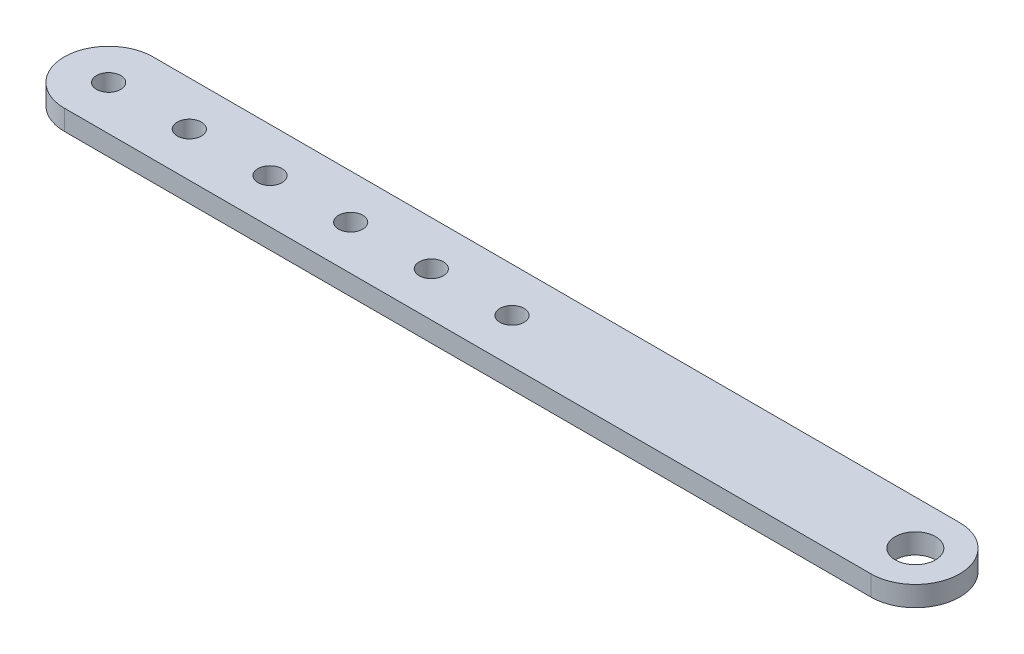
SolidWorks part; units mm, degrees
ref_plane "Front" through (0, 0, 0) normal (0, 0, 1) x (1, 0, 0)
ref_plane "Top" through (0, 0, 0) normal (0, 1, 0) x (1, 0, 0)
ref_plane "Right" through (0, 0, 0) normal (1, 0, 0) x (0, 0, -1)
sketch "Sketch2" plane through (0, 0, 0) normal (0, 1, 0) x (1, 0, 0)
  line L0 (0, 0) -> (200, 0) construction
  line L1 (0, 11) -> (200, 11)
  line L2 (0, -11) -> (200, -11)
  arc A0 (0, 11) -> (0, -11) centre (0, 0) ccw
  arc A1 (200, 11) -> (200, -11) centre (200, 0) cw
  dimension "D1" = 200
  dimension "D2" = 22
extrude "Base-Extrude" add sketch "Sketch2" along normal blind 5
sketch "Sketch3" plane through (0, 5, 0) normal (0, 1, 0) x (-1, 0, 0)
  circle A0 centre (0, 0) radius 3
  dimension "D1" = 6
extrude "Cut-Extrude1" cut sketch "Sketch3" against normal through all
pattern_linear "LPattern1" count 6 spacing 20 along (1, 0, 0) of "Cut-Extrude1"
sketch "Sketch5" plane through (0, 5, 0) normal (0, 1, 0) x (-1, 0, 0)
  circle A0 centre (-200, 0) radius 5
  arc A1 (-200, 11) -> (-200, -11) centre (-200, 0) ccw construction
  dimension "D1" = 10
extrude "Cut-Extrude2" cut sketch "Sketch5" against normal through all
